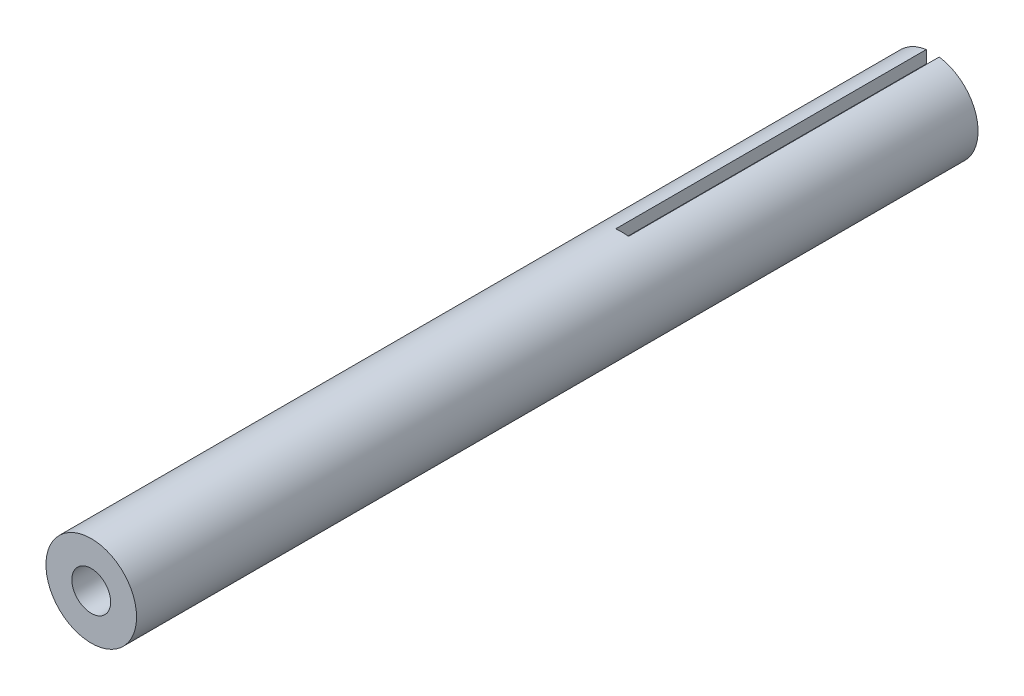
SolidWorks part; units mm, degrees
ref_plane "Front Plane" through (0, 0, 0) normal (0, 0, 1) x (1, 0, 0)
ref_plane "Top Plane" through (0, 0, 0) normal (0, 1, 0) x (1, 0, 0)
ref_plane "Right Plane" through (0, 0, 0) normal (1, 0, 0) x (0, 0, -1)
sketch "Sketch1" plane through (0, 0, 0) normal (0, 0, 1) x (1, 0, 0)
  circle A0 centre (0, 0) radius 11.1125
  circle A1 centre (0, 0) radius 4.7625
  dimension "D1" = 22.225
  dimension "D2" = 9.525
extrude "Boss-Extrude1" add sketch "Sketch1" along normal blind 206.375
ref_plane "Plane1" through (0, 11.1125, 0) normal (0, 1, 0) x (1, 0, 0)
sketch "Sketch2" plane through (0, 11.1125, 0) normal (0, 1, 0) x (1, 0, 0)
  line L1 (-1.5875, 0) -> (1.5875, 0)
  line L2 (-1.5875, 0) -> (-1.5875, -76.2)
  line L3 (-1.5875, -76.2) -> (1.5875, -76.2)
  line L4 (1.5875, 0) -> (1.5875, -76.2)
  line L6 (11.1125, 0) -> (-11.1125, 0) construction
  dimension "D1" = 76.2
  dimension "D2" = 3.175
  dimension "D4" = 1.5875
extrude "Cut-Extrude1" cut sketch "Sketch2" against normal blind 3.175
